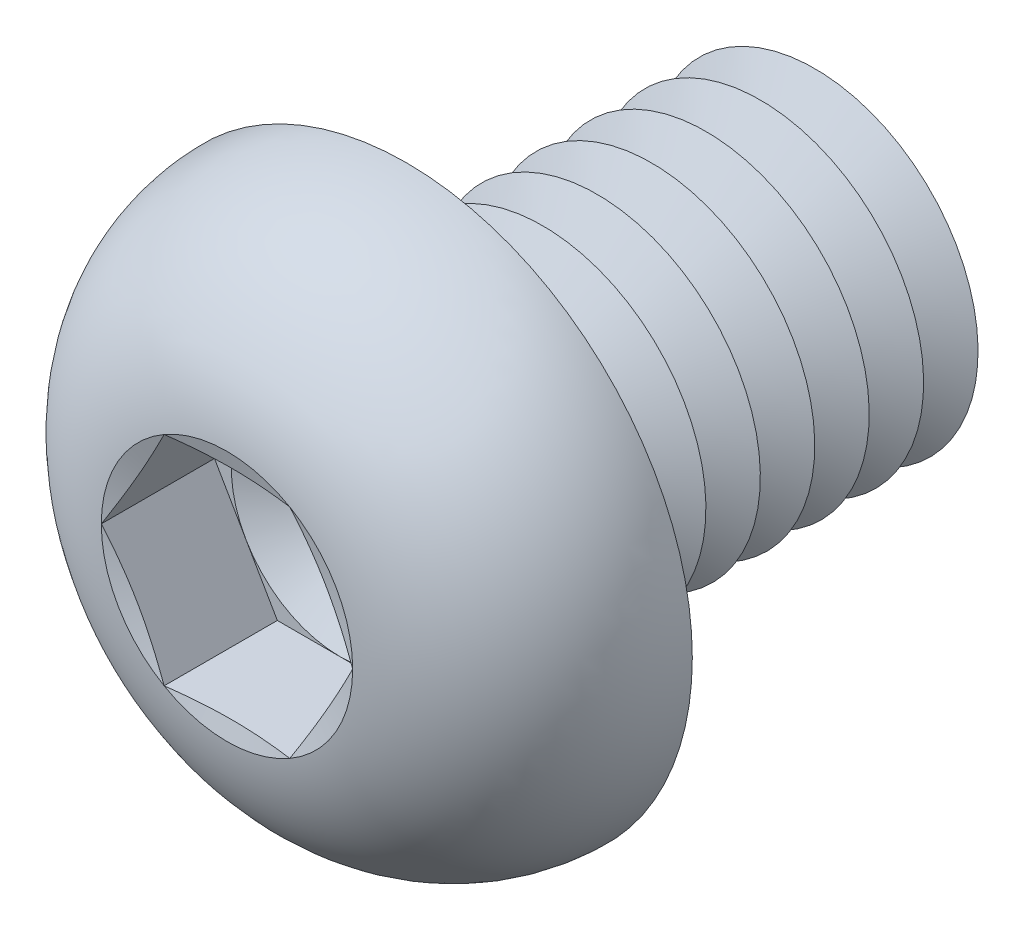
SolidWorks part; units mm, degrees
ref_plane "Front Plane" through (0, 0, 0) normal (0, 0, 1) x (1, 0, 0)
ref_plane "Top Plane" through (0, 0, 0) normal (0, 1, 0) x (1, 0, 0)
ref_plane "Right Plane" through (0, 0, 0) normal (1, 0, 0) x (0, 0, -1)
sketch "Sketch1" plane through (0, 0, 0) normal (1, 0, 0) x (0, 0, -1)
  line L0 (0, 3) -> (0, 5.25)
  line L3 (0, 3) -> (8, 3)
  line L4 (8, 3) -> (8, 0)
  line L5 (8, 0) -> (-3.3, 0) construction
  line L6 (-3.3, 0) -> (8, 0)
  line L7 (-3.3, 2.3094) -> (-3.3, 1.1547) construction
  line L8 (-3.3, 1.1547) -> (-3.3, 0)
  line L9 (-3.3, 2.3094) -> (-2.9906, 1.1547)
  line L10 (-2.9906, 1.1547) -> (-3.3, 1.1547)
  line L11 (8, 0) -> (22.7481, 0) construction
  line L12 (0, 5.25) -> (-3.3, 5.25) construction
  arc A1 (0, 5.25) -> (-3.3, 2.3094) centre (0, 1.928) ccw
  point P8 (8, 1.5)
  dimension "D1" = 10.5
  dimension "D2" = 6
  dimension "D3" = 3.3
  dimension "D4" = 4.6188
  dimension "D5" = 8
  dimension "D6" = 15
revolve "Revolve1" add sketch "Sketch1" angle 360 about L5
fillet "Fillet1" radius 0.5 1 edges at (0, 3, 0)
sketch "Sketch2" plane through (0, 0, 0) normal (1, 0, 0) x (0, 0, -1)
  line L0 (7.5, 3) -> (8.5, 3)
  line L1 (8, 3) -> (0.5, 3) construction
  line L2 (8.5, 3) -> (8, 2.134)
  line L3 (8, -3) -> (8, 3) construction
  line L4 (8, 2.134) -> (7.5, 3)
  dimension "D1" = 1
revolve "Cut-Revolve1" cut sketch "Sketch2" angle 360 about axis through (0, 0, -8) along (0, 0, -1)
pattern_linear "LPattern1" count 8 spacing 1 along (0, 0, 1) of "Cut-Revolve1"
sketch "Sketch3" plane through (0, 0, 3.3) normal (0, 0, 1) x (1, 0, 0)
  line L7 (1.1547, 2) -> (-1.1547, 2)
  line L8 (-1.1547, 2) -> (-2.3094, 0)
  line L9 (-2.3094, 0) -> (-1.1547, -2)
  line L10 (-1.1547, -2) -> (1.1547, -2)
  line L11 (1.1547, -2) -> (2.3094, 0)
  line L12 (2.3094, 0) -> (1.1547, 2)
  circle A0 centre (0, 0) radius 2 construction
  circle A3 centre (0, 0) radius 2.3094 construction
extrude "Cut-Extrude1" cut sketch "Sketch3" against normal blind 2.08
sketch "Sketch4" plane through (0, 0, 1.22) normal (0, 0, 1) x (1, 0, 0)
  line L1 (1.1547, 2) -> (-1.1547, 2) construction
  circle A0 centre (0, 0) radius 2
extrude "Cut-Extrude2" cut sketch "Sketch4" against normal through all draft 60
